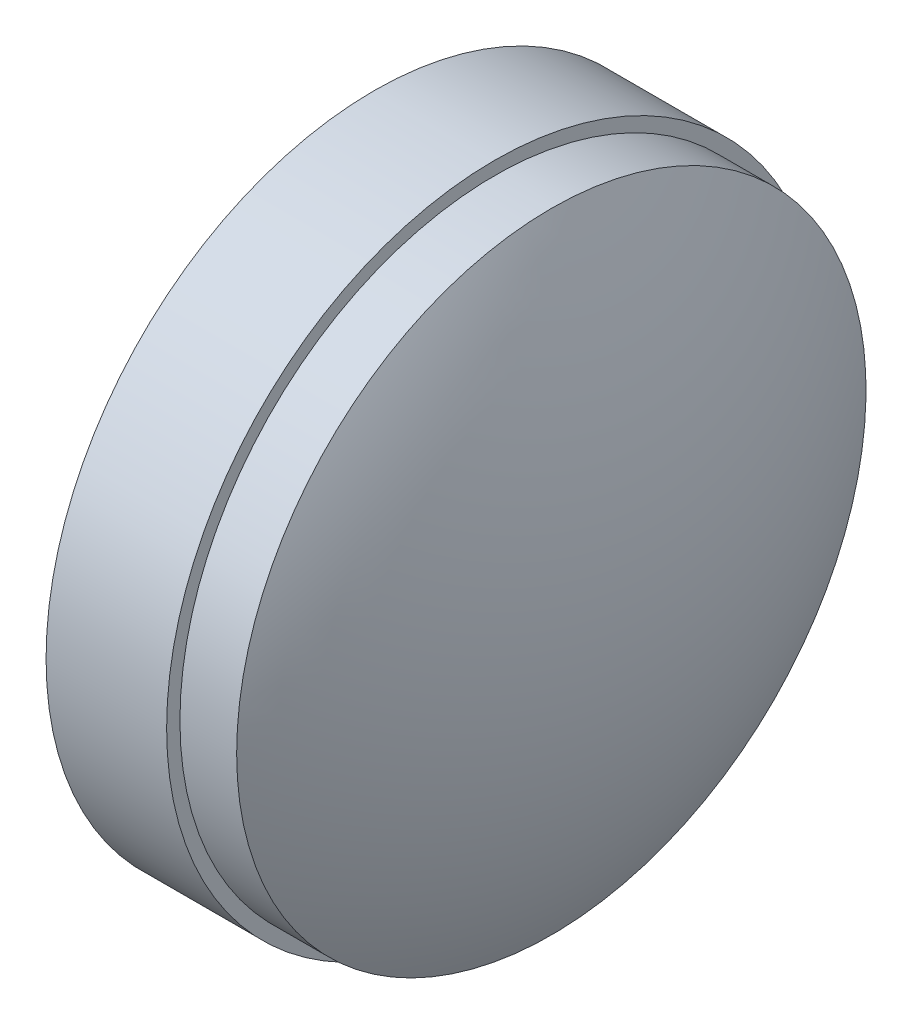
SolidWorks part; units mm, degrees
ref_plane "Front Plane" through (0, 0, 0) normal (0, 0, 1) x (1, 0, 0)
ref_plane "Top Plane" through (0, 0, 0) normal (0, 1, 0) x (1, 0, 0)
ref_plane "Right Plane" through (0, 0, 0) normal (1, 0, 0) x (0, 0, -1)
sketch "Sketch1" plane through (0, 0, 0) normal (0, 0, 1) x (1, 0, 0)
  line L1 (0, 9.25) -> (3.4, 9.25)
  line L3 (3.4, -9.25) -> (0, -9.25)
  line L5 (-5.4275, 0) -> (11.1658, 0) construction
  line L6 (3.4, 9.25) -> (3.4, 8.875)
  line L9 (3.4, 8.875) -> (5, 8.875)
  line L11 (3.4, -8.875) -> (5, -8.875)
  line L12 (3.4, -8.875) -> (3.4, -9.25)
  arc A0 (5, 8.875) -> (5, -8.875) centre (-11.2143, 0) cw
  arc A1 (0, 9.25) -> (0, -9.25) centre (-42.2813, 0) cw
revolve "Revolve1" add sketch "Sketch1" angle 360 about L5
